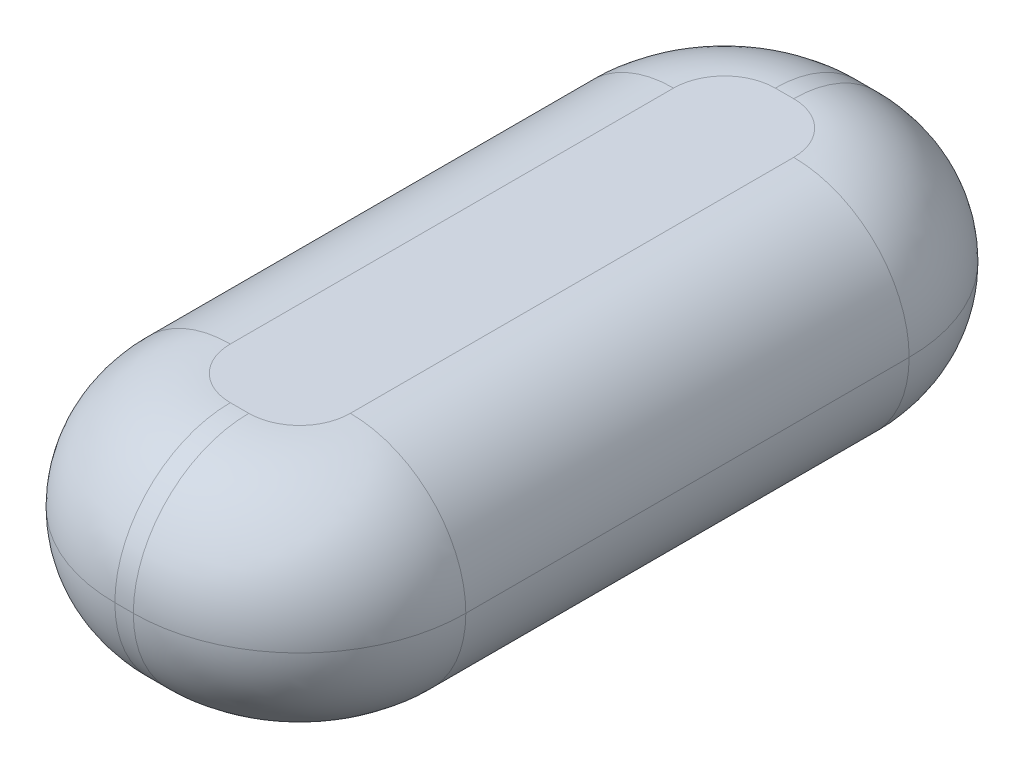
SolidWorks part; units mm, degrees
ref_plane "Front Plane" through (0, 0, 0) normal (0, 0, 1) x (1, 0, 0)
ref_plane "Top Plane" through (0, 0, 0) normal (0, 1, 0) x (1, 0, 0)
ref_plane "Right Plane" through (0, 0, 0) normal (1, 0, 0) x (0, 0, -1)
sketch "Sketch1" plane through (0, 0, 0) normal (0, 1, 0) x (1, 0, 0)
  line L1 (-1, 42) -> (1, 42)
  line L2 (-19, 24) -> (-19, -24)
  line L3 (-1, -42) -> (1, -42)
  line L4 (19, 24) -> (19, -24)
  line L5 (-19, 42) -> (19, -42) construction
  line L6 (-19, -42) -> (19, 42) construction
  arc A0 (-19, -24) -> (-1, -42) centre (-1, -24) ccw
  arc A1 (1, -42) -> (19, -24) centre (1, -24) ccw
  arc A2 (1, 42) -> (19, 24) centre (1, 24) cw
  arc A3 (-1, 42) -> (-19, 24) centre (-1, 24) ccw
  point P0 (0, 0)
  dimension "D3" = 18
  dimension "D1" = 84
  dimension "D2" = 38
extrude "Boss-Extrude1" add sketch "Sketch1" along normal mid plane 25
fillet "Fillet1" radius 12.5 16 edges at (0, -12.5, 42) (13.7279, -12.5, 36.7279) (19, -12.5, 0) (13.7279, -12.5, -36.7279) (0, -12.5, -42) (-13.7279, -12.5, -36.7279) (-19, -12.5, 0) (-13.7279, -12.5, 36.7279) (-19, 12.5, 0) (-13.7279, 12.5, -36.7279) (0, 12.5, -42) (13.7279, 12.5, -36.7279) (19, 12.5, 0) (13.7279, 12.5, 36.7279) (0, 12.5, 42) (-13.7279, 12.5, 36.7279)
